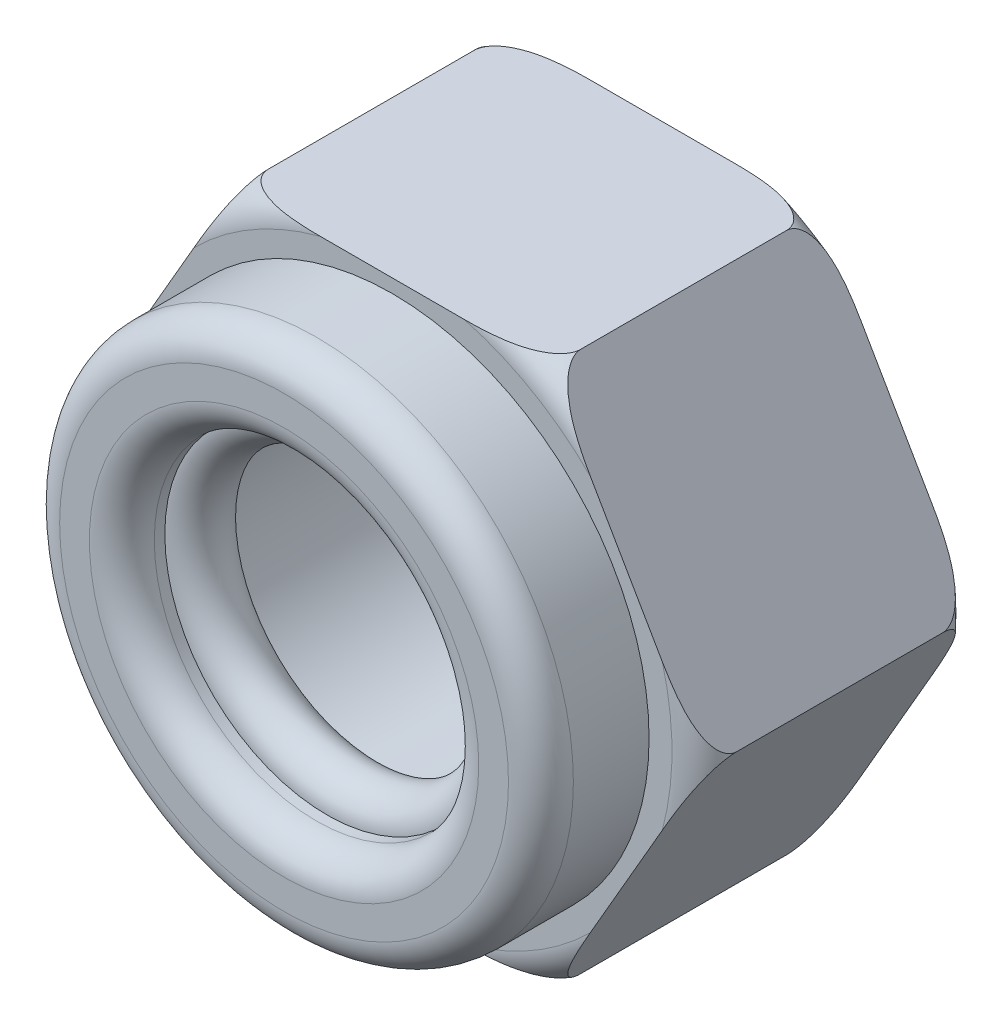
SolidWorks part; units mm, degrees
ref_plane "Plan de face" through (0, 0, 0) normal (0, 0, 1) x (1, 0, 0)
ref_plane "Plan de dessus" through (0, 0, 0) normal (0, 1, 0) x (1, 0, 0)
ref_plane "Plan de droite" through (0, 0, 0) normal (1, 0, 0) x (0, 0, -1)
sketch "Esquisse1" plane through (0, 0, 0) normal (0, 0, 1) x (1, 0, 0)
  line L0 (0, 0) -> (2.8868, 0) construction
  line L1 (2.8868, 0) -> (1.4434, 2.5)
  line L2 (1.4434, 2.5) -> (-1.4434, 2.5)
  line L3 (-1.4434, 2.5) -> (-2.8868, 0)
  line L4 (-2.8868, 0) -> (-1.4434, -2.5)
  line L5 (-1.4434, -2.5) -> (1.4434, -2.5)
  line L6 (1.4434, -2.5) -> (2.8868, 0)
  circle A0 centre (0, 0) radius 2.5 construction
  circle A1 centre (0, 0) radius 1.5
  dimension "D2" = 3
  dimension "D1" = 5
extrude "Boss.-Extru.1" add sketch "Esquisse1" along normal blind 2.5
sketch "Esquisse2" plane through (0, 0, 2.5) normal (0, 0, 1) x (1, 0, 0)
  circle A0 centre (0, 0) radius 2.375
  circle A1 centre (0, 0) radius 1.5
  circle A2 centre (0, 0) radius 1.5 construction
  dimension "D1" = 4.75
extrude "Boss.-Extru.2" add sketch "Esquisse2" along normal blind 1
fillet "Congé1" radius 0.3 2 edges at (1.5, 0, 3.5) (2.375, 0, 3.5)
sketch "Esquisse3" plane through (0, 0, 0) normal (0, 1, 0) x (1, 0, 0)
  line L0 (2.8868, -2.5) -> (1.4434, -2.5) construction
  line L1 (2.8868, -2.5) -> (2.8868, 0) construction
  line L2 (2.8868, -1.25) -> (-2.8868, -1.25) construction
  line L3 (-2.8868, -2.5) -> (-2.8868, 0) construction
  line L4 (2.8868, -2.2) -> (2.8868, -2.5)
  line L5 (2.8868, -2.5) -> (2.5868, -2.5)
  line L6 (2.8868, 0) -> (2.5868, 0)
  line L7 (2.8868, -0.3) -> (2.8868, 0)
  line L8 (0, 0) -> (0, -2.5) construction
  line L9 (-2.375, -2.5) -> (2.375, -2.5) construction
  arc A0 (2.5868, -2.5) -> (2.8868, -2.2) centre (2.5868, -2.2) ccw
  arc A1 (2.5868, 0) -> (2.8868, -0.3) centre (2.5868, -0.3) cw
  dimension "D1" = 0.3
revolve "Enlèvement de matière-Révolution1" cut sketch "Esquisse3" angle 360 about L8
sketch "Esquisse4" plane through (0, 0, 0) normal (0, 1, 0) x (1, 0, 0)
  line L0 (1.5, -3.2) -> (1.5, 0) construction
  line L1 (0, 0) -> (0, -3.5) construction
  line L2 (-2.075, -3.5) -> (2.075, -3.5) construction
  circle A0 centre (1.5, -2.8317) radius 0.271
revolve "Révolution1" add sketch "Esquisse4" angle 360 about L1
